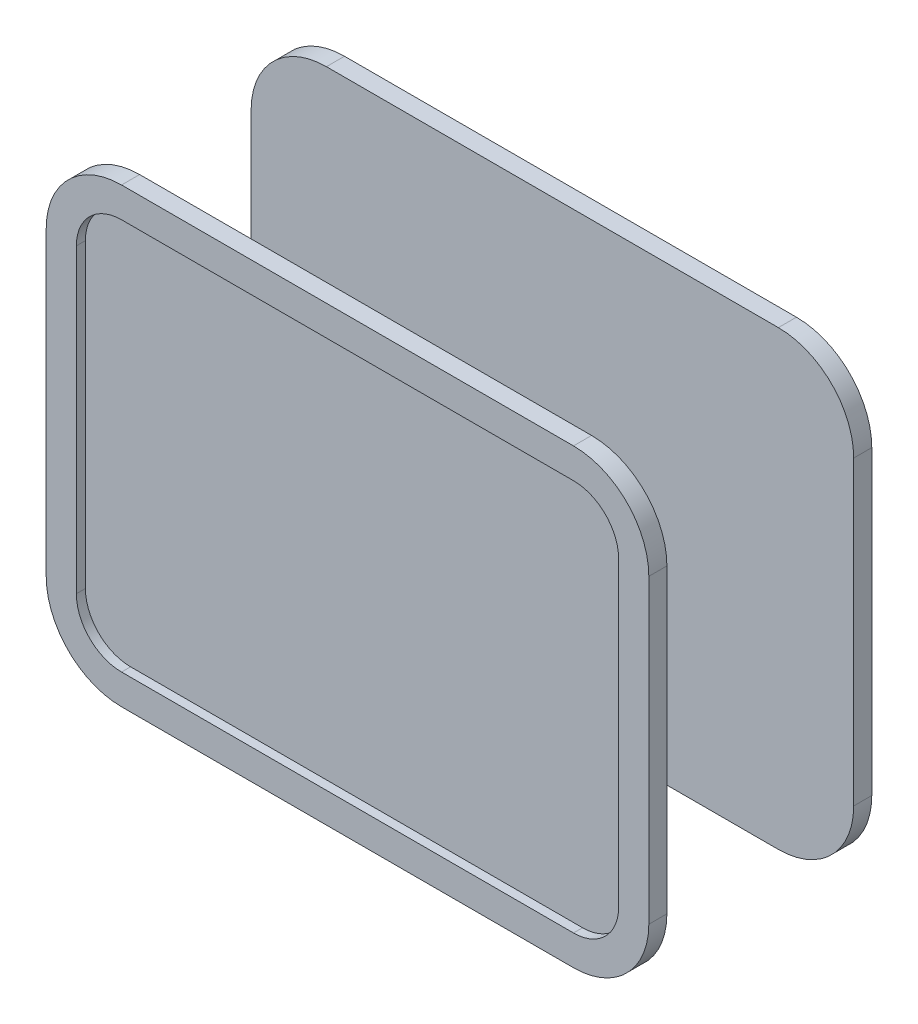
SolidWorks part; units mm, degrees
ref_plane "Plan de face" through (0, 0, 0) normal (0, 0, 1) x (1, 0, 0)
ref_plane "Plan de dessus" through (0, 0, 0) normal (0, 1, 0) x (1, 0, 0)
ref_plane "Plan de droite" through (0, 0, 0) normal (1, 0, 0) x (0, 0, -1)
sketch "Esquisse1" plane through (0, 0, 0) normal (0, 0, 1) x (1, 0, 0)
  line L1 (-35, 75) -> (115, 75)
  line L2 (-60, 50) -> (-60, -50)
  line L3 (-35, -75) -> (115, -75)
  line L4 (140, 50) -> (140, -50)
  arc A0 (115, -75) -> (140, -50) centre (115, -50) ccw
  arc A1 (-60, -50) -> (-35, -75) centre (-35, -50) ccw
  arc A2 (-35, 75) -> (-60, 50) centre (-35, 50) ccw
  arc A3 (115, 75) -> (140, 50) centre (115, 50) cw
  dimension "D5" = 25
  dimension "D1" = 200
  dimension "D2" = 60
  dimension "D3" = 150
  dimension "D4" = 75
extrude "Boss.-Extru.1" add sketch "Esquisse1" along normal blind 6 from offset 31
sketch "Esquisse2" plane through (0, 0, 37) normal (0, 0, 1) x (1, 0, 0)
  line L12 (130, -50) -> (130, 50)
  line L13 (115, 65) -> (-35, 65)
  line L14 (-50, 50) -> (-50, -50)
  line L15 (-35, -65) -> (115, -65)
  line L16 (130, -50) -> (130, 50)
  line L17 (115, 65) -> (-35, 65)
  line L18 (-50, 50) -> (-50, -50)
  line L19 (-35, -65) -> (115, -65)
  arc A12 (115, -65) -> (130, -50) centre (115, -50) ccw
  arc A13 (130, 50) -> (115, 65) centre (115, 50) ccw
  arc A14 (-35, 65) -> (-50, 50) centre (-35, 50) ccw
  arc A15 (-50, -50) -> (-35, -65) centre (-35, -50) ccw
  arc A16 (115, -65) -> (130, -50) centre (115, -50) ccw
  arc A17 (130, 50) -> (115, 65) centre (115, 50) ccw
  arc A18 (-35, 65) -> (-50, 50) centre (-35, 50) ccw
  arc A19 (-50, -50) -> (-35, -65) centre (-35, -50) ccw
  dimension "D1" = 10
extrude "Enlèv. mat.-Extru.1" cut sketch "Esquisse2" against normal blind 3
sketch "Esquisse4" plane through (0, 0, 0) normal (0, 0, 1) x (1, 0, 0)
  circle A0 centre (0, 0) radius 7
  circle A1 centre (0, 0) radius 4
  dimension "D1" = 14
  dimension "D2" = 8
extrude "Boss.-Extru.3" add sketch "Esquisse4" along normal mid plane 62
sketch "Esquisse5" plane through (0, 0, 0) normal (1, 0, 0) x (0, 0, -1)
  circle A0 centre (0, 0) radius 7
  circle A1 centre (0, 0) radius 4
  dimension "D1" = 14
  dimension "D2" = 8
extrude "Boss.-Extru.4" add sketch "Esquisse5" against normal blind 90 and the other way blind 12
sketch "Esquisse6" plane through (0, 0, 0) normal (0, 1, 0) x (1, 0, 0)
  line L1 (-11, 11) -> (11, 11)
  line L2 (-11, 11) -> (-11, -11)
  line L3 (-11, -11) -> (11, -11)
  line L4 (11, 11) -> (11, -11)
  dimension "D1" = 22
  dimension "D2" = 11
  dimension "D3" = 11
  dimension "D4" = 22
extrude "Boss.-Extru.5" add sketch "Esquisse6" along normal mid plane 22
mirror "Symétrie1" about plane through (0, 0, 0) normal (0, 0, 1) of "Enlèv. mat.-Extru.1", "Boss.-Extru.1"
